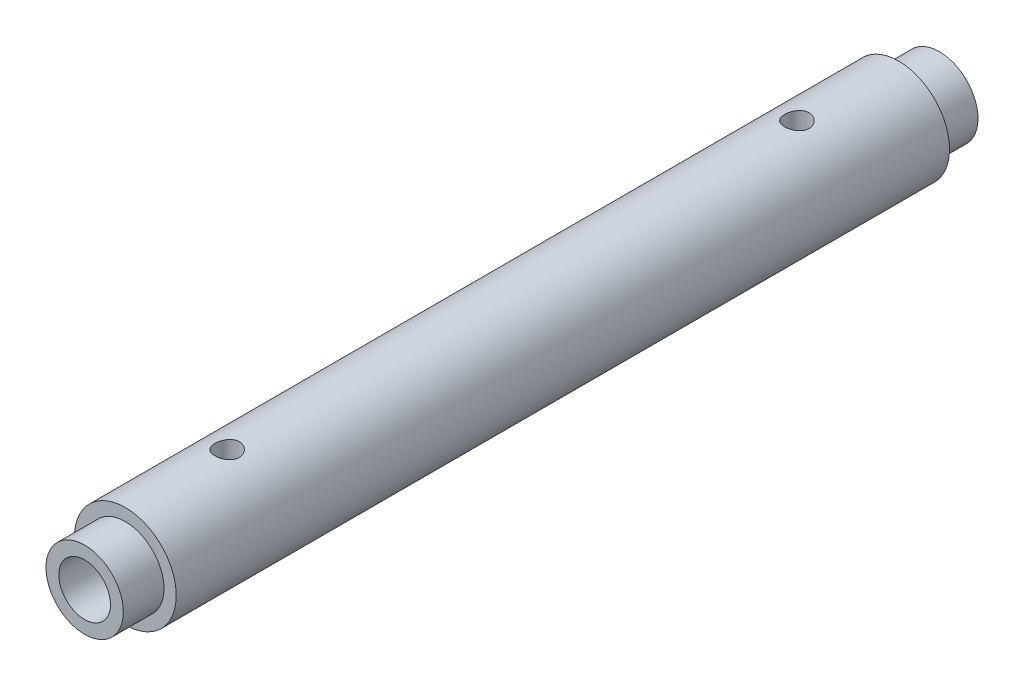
SolidWorks part; units mm, degrees
ref_plane "Спереди" through (0, 0, 0) normal (0, 0, 1) x (1, 0, 0)
ref_plane "Сверху" through (0, 0, 0) normal (0, 1, 0) x (1, 0, 0)
ref_plane "Справа" through (0, 0, 0) normal (1, 0, 0) x (0, 0, -1)
sketch "Эскиз1" plane through (0, 0, 0) normal (1, 0, 0) x (0, 0, -1)
  line L0 (0, 0) -> (0, 6.35)
  line L1 (0, 6.35) -> (-50, 6.35)
  line L2 (-50, 6.35) -> (-50, 9.5)
  line L3 (-50, 9.5) -> (-40, 9.5)
  line L4 (-40, 9.5) -> (-40, 12.5)
  line L5 (-40, 12.5) -> (150, 12.5)
  line L6 (150, 12.5) -> (150, 9.5)
  line L7 (150, 9.5) -> (160, 9.5)
  line L8 (160, 9.5) -> (160, 6.35)
  line L9 (160, 6.35) -> (110, 6.35)
  line L10 (110, 6.35) -> (110, 0)
  line L11 (110, 0) -> (0, 0)
  dimension "D1" = 6.35
  dimension "D2" = 50
  dimension "D3" = 210
  dimension "D4" = 190
  dimension "D5" = 12.5
  dimension "D6" = 9.5
revolve "Повернуть1" add sketch "Эскиз1" angle 360 about L11
sketch "Эскиз2" plane through (0, 0, 0) normal (0, 1, 0) x (1, 0, 0)
  line L0 (9.5, 160) -> (-9.5, 160) construction
  line L1 (-9.5, -50) -> (9.5, -50) construction
  circle A0 centre (0, -15) radius 3
  circle A1 centre (0, 125) radius 3
  dimension "D1" = 6
  dimension "D2" = 35
  dimension "D3" = 35
extrude "Вырез-Вытянуть1" cut sketch "Эскиз2" against normal mid plane 30
